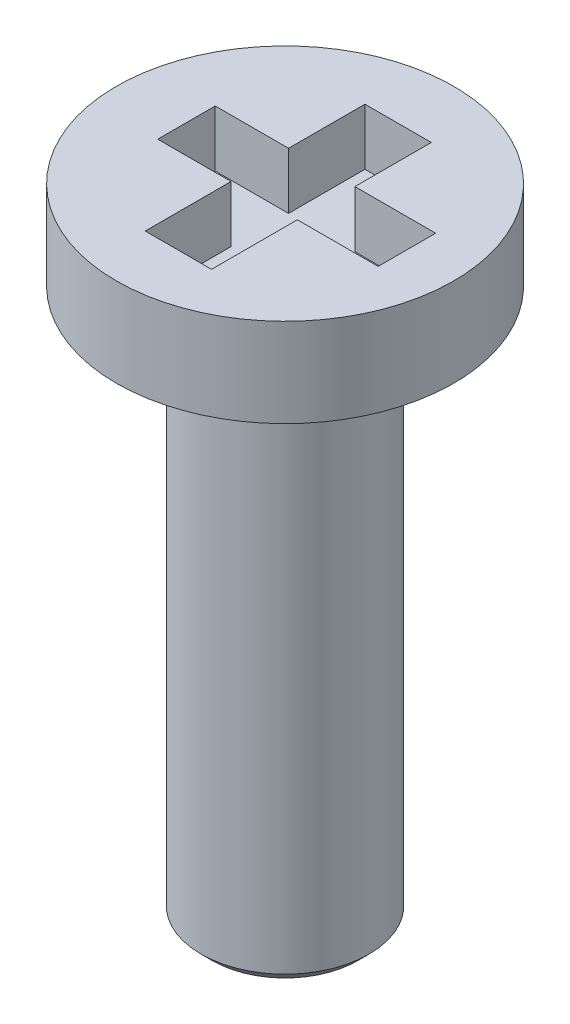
SolidWorks part; units mm, degrees
ref_plane "Plan de face" through (0, 0, 0) normal (0, 0, 1) x (1, 0, 0)
ref_plane "Plan de dessus" through (0, 0, 0) normal (0, 1, 0) x (1, 0, 0)
ref_plane "Plan de droite" through (0, 0, 0) normal (1, 0, 0) x (0, 0, -1)
sketch "Esquisse1" plane through (0, 0, 0) normal (0, 0, 1) x (1, 0, 0)
  line L0 (0, 19.6204) -> (0, -12.1532) construction
  line L1 (0, 0) -> (1.49, 0)
  line L2 (1.49, 0) -> (1.49, 9.7147)
  line L3 (1.49, 9.7147) -> (2.99, 9.7147)
  line L4 (2.99, 9.7147) -> (2.99, 11.2867)
  line L5 (2.99, 11.2867) -> (0, 11.2867)
  line L6 (0, 11.2867) -> (0, 7)
  line L8 (0, 0) -> (0, 7)
revolve "Révolution1" add sketch "Esquisse1" angle 360 about L0
sketch "Esquisse2" plane through (0, 11.2867, 0) normal (0, 1, 0) x (1, 0, 0)
  line L0 (0.6644, 0.5736) -> (2.0965, 0.5736)
  line L1 (-1.8114, 0.5736) -> (-0.5117, 0.5736)
  line L2 (-1.8114, 0.5736) -> (-1.8114, -0.4464)
  line L3 (-1.8114, -0.4464) -> (-0.5117, -0.4464)
  line L4 (2.0965, 0.5736) -> (2.0965, -0.4464)
  line L5 (-0.5117, 1.9279) -> (0.6644, 1.9279)
  line L6 (-0.5117, 1.9279) -> (-0.5117, 0.5736)
  line L7 (-0.5117, -1.9677) -> (0.6644, -1.9677)
  line L8 (0.6644, 1.9279) -> (0.6644, 0.5736)
  line L9 (-0.5117, -0.4464) -> (-0.5117, -1.9677)
  line L10 (0.6644, -0.4464) -> (0.6644, -1.9677)
  line L11 (0.6644, -0.4464) -> (2.0965, -0.4464)
extrude "Extrusion1" cut sketch "Esquisse2" against normal blind 1
chamfer "Chanfrein1" distance 0.2 angle 45 1 edges at (0, 0, 1.49)
